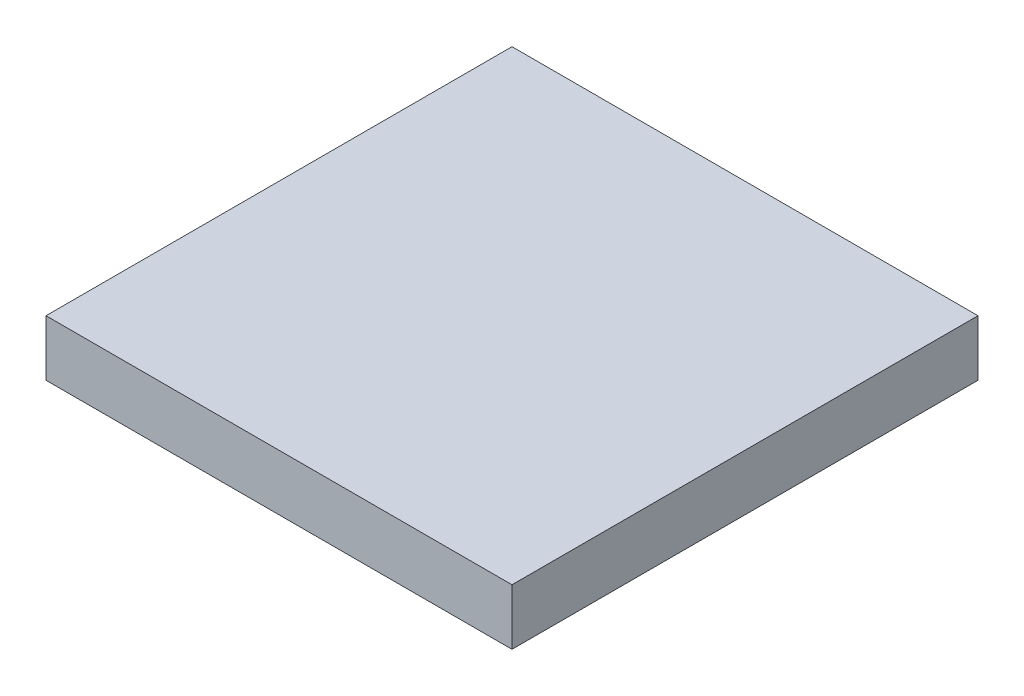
SolidWorks part; units mm, degrees
ref_plane "Plan de face" through (0, 0, 0) normal (0, 0, 1) x (1, 0, 0)
ref_plane "Plan de dessus" through (0, 0, 0) normal (0, 1, 0) x (1, 0, 0)
ref_plane "Plan de droite" through (0, 0, 0) normal (1, 0, 0) x (0, 0, -1)
sketch "Esquisse1" plane through (0, 0, 0) normal (0, 1, 0) x (1, 0, 0)
  line L1 (0, 0) -> (100, 0)
  line L2 (0, 0) -> (0, 100)
  line L3 (0, 100) -> (100, 100)
  line L4 (100, 0) -> (100, 100)
  dimension "D1" = 100
  dimension "D2" = 100
extrude "Boss.-Extru.1" add sketch "Esquisse1" along normal blind 12
